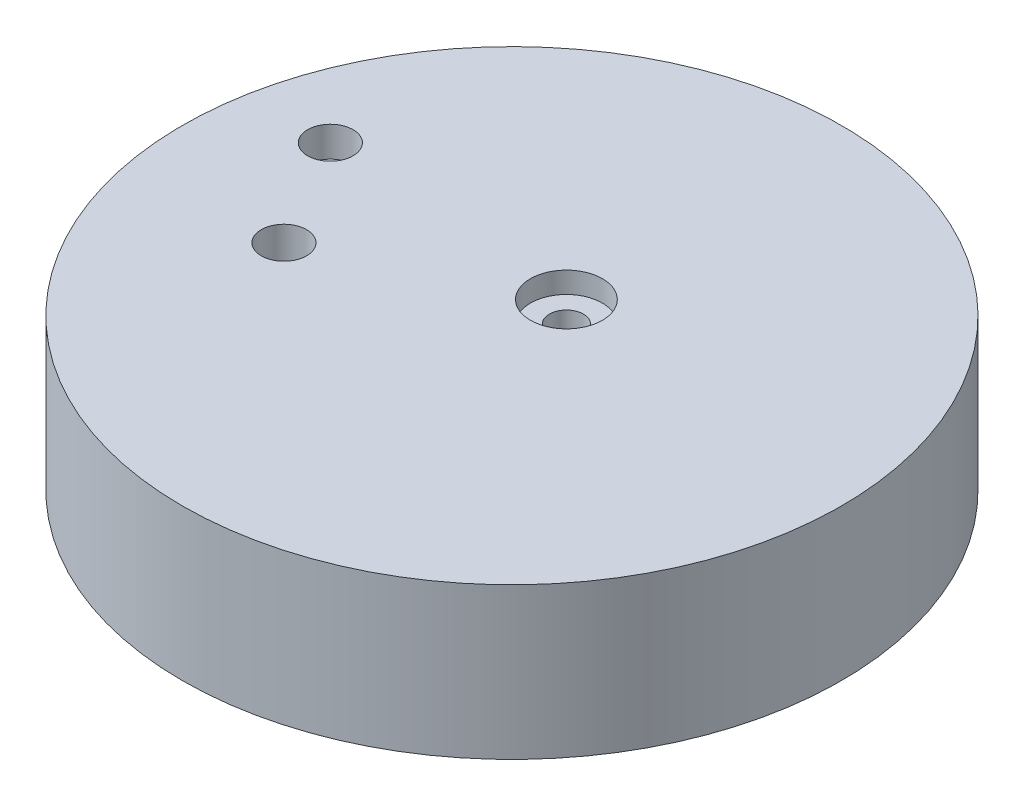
SolidWorks part; units mm, degrees
ref_plane "Front Plane" through (0, 0, 0) normal (0, 0, 1) x (1, 0, 0)
ref_plane "Top Plane" through (0, 0, 0) normal (0, 1, 0) x (1, 0, 0)
ref_plane "Right Plane" through (0, 0, 0) normal (1, 0, 0) x (0, 0, -1)
sketch "Sketch11" plane through (0, 0, 0) normal (0, 1, 0) x (1, 0, 0)
  circle A0 centre (0, 0) radius 65.3548
extrude "Boss-Extrude3" add sketch "Sketch11" along normal blind 30
hole_wizard "CBORE for 1/4 Binding Head Machine Screw1" positions "3DSketch1" profile "Sketch15" counterbore size "1/4" standard "ANSI Inch"
sketch3d "3DSketch1"
  point P3 (2.6175, 30, -8.1851)
  point P6 (0, 0, 0)
sketch "Sketch15" plane through (2.6175, 30, -8.1851) normal (1, 0, 0) x (0, 0, 1)
  line L0 (0, 0) -> (0, 30)
  line L1 (0, 30) -> (3.3782, 30)
  line L3 (3.3782, 30) -> (3.3782, 4.191)
  line L4 (3.3782, 4.191) -> (7.1437, 4.191)
  line L5 (7.1437, 4.191) -> (7.1437, 0)
  line L7 (7.1437, 0) -> (0, 0)
  line L11 (0, -6.35) -> (0, 107.95) construction
  dimension "Thru Hole Dia." = 6.7564
  dimension "Thru Hole Depth" = 30
  dimension "C'Bore Dia." = 14.2875
  dimension "C'Bore Depth" = 4.191
sketch "Sketch19" plane through (0, 0, 0) normal (0, -1, 0) x (1, 0, 0)
  circle A0 centre (-27.0424, 3.0842) radius 2.3065
hole_wizard "M10x1.0 Tapped Hole1" positions "Sketch27" profile "Sketch28" tap size "M10x1.0" standard "GB"
sketch "Sketch27" plane through (0, 30, 0) normal (0, 1, 0) x (1, 0, 0)
  point P0 (-47.7064, 11.6977)
sketch "Sketch28" plane through (-47.7064, 30, -11.6977) normal (1, 0, 0) x (0, 0, 1)
  line L0 (0, 0) -> (0, 8.7039)
  line L1 (0, 8.7039) -> (4.5, 6)
  line L2 (4.5, 6) -> (4.5, 0)
  line L5 (4.5, 0) -> (0, 0)
  line L10 (0, 8.7039) -> (-4.5, 6) construction
  line L11 (0, -6.35) -> (0, 107.95) construction
  dimension "Tap Drill Dia." = 9
  dimension "Tap Drill Depth" = 6
  dimension "Drill Angle" = 118
hole_wizard "M10x1.0 Tapped Hole2" positions "Sketch31" profile "Sketch32" tap size "M10x1.0" standard "ISO"
sketch "Sketch31" plane through (0, 30, 0) normal (0, 1, 0) x (1, 0, 0)
  point P0 (-35.14, -10.0773)
sketch "Sketch32" plane through (-35.14, 30, 10.0773) normal (1, 0, 0) x (0, 0, 1)
  line L0 (0, 0) -> (0, 25.7039)
  line L1 (0, 25.7039) -> (4.5, 23)
  line L2 (4.5, 23) -> (4.5, 0)
  line L5 (4.5, 0) -> (0, 0)
  line L10 (0, 25.7039) -> (-4.5, 23) construction
  line L11 (0, -6.35) -> (0, 107.95) construction
  dimension "Tap Drill Dia." = 9
  dimension "Tap Drill Depth" = 23
  dimension "Drill Angle" = 118
